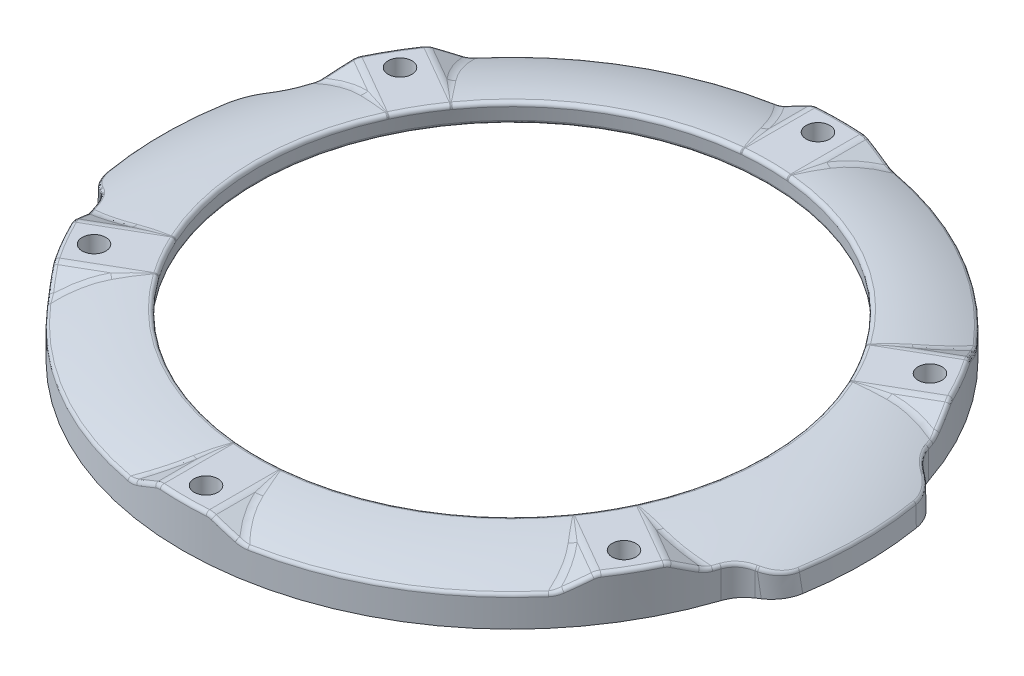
SolidWorks part; units mm, degrees
other "<WTE3-P-RETAINING-RING-R1>-<Fillet7>"
ref_plane "Front Plane" through (0, 0, 0) normal (0, 0, 1) x (1, 0, 0)
ref_plane "Top Plane" through (0, 0, 0) normal (0, 1, 0) x (1, 0, 0)
ref_plane "Right Plane" through (0, 0, 0) normal (1, 0, 0) x (0, 0, -1)
inserted part "WTE3-P-RETAINING-RING-R1"
